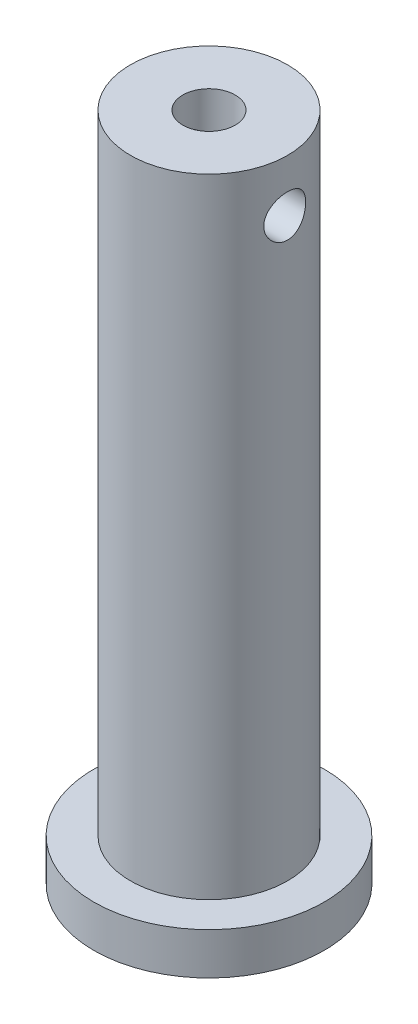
SolidWorks part; units mm, degrees
ref_plane "face" through (0, 0, 0) normal (0, 0, 1) x (1, 0, 0)
ref_plane "dessus" through (0, 0, 0) normal (0, 1, 0) x (1, 0, 0)
ref_plane "profil" through (0, 0, 0) normal (1, 0, 0) x (0, 0, -1)
sketch "Esquisse1" plane through (0, 0, 0) normal (0, 0, 1) x (1, 0, 0)
  line L0 (0, -9.9279) -> (0, 66.6589) construction
  line L1 (0, 0) -> (5.5, 0)
  line L2 (5.5, 0) -> (5.5, 2)
  line L3 (5.5, 2) -> (3.75, 2)
  line L4 (3.75, 2) -> (3.75, 32)
  line L5 (3.75, 32) -> (0, 32)
  line L6 (0, 32) -> (0, 0)
  dimension "D1" = 5.5
  dimension "D2" = 2
  dimension "D3" = 3.75
  dimension "D4" = 32
revolve "Base-Révolution" add sketch "Esquisse1" angle 360 about L0
hole_wizard "Perçage1" positions "Esquisse3" profile "Esquisse2" legacy
sketch "Esquisse3" plane through (0, 32, 0) normal (0, 1, 0) x (-1, 0, 0)
  point P0 (0, 0)
sketch "Esquisse2" plane through (0, 32, 0) normal (1, 0, 0) x (0, 0, 1)
  line L0 (0, 0) -> (0, 18.2511)
  line L1 (0, 18.2511) -> (1.25, 17.5)
  line L2 (1.25, 17.5) -> (1.25, 0)
  line L4 (1.25, 0) -> (0, 0)
  line L6 (0, 18.2511) -> (-1.25, 17.5) construction
  line L7 (0, -4.2442) -> (0, 117.3081) construction
  dimension "Diamètre" = 2.5
  dimension "Profondeur" = 17.5
  dimension "Angle" = 118
sketch "Esquisse4" plane through (0, 0, 0) normal (1, 0, 0) x (0, 0, -1)
  line L0 (0, 14.5) -> (0, 13.7489) construction
  line L1 (3.75, 32) -> (-3.75, 32) construction
  circle A0 centre (0, 29.5) radius 1
  dimension "D2" = 2
  dimension "D1" = 2.5
extrude "Enlèv. mat.-Extru.1" cut sketch "Esquisse4" against normal mid plane 10
